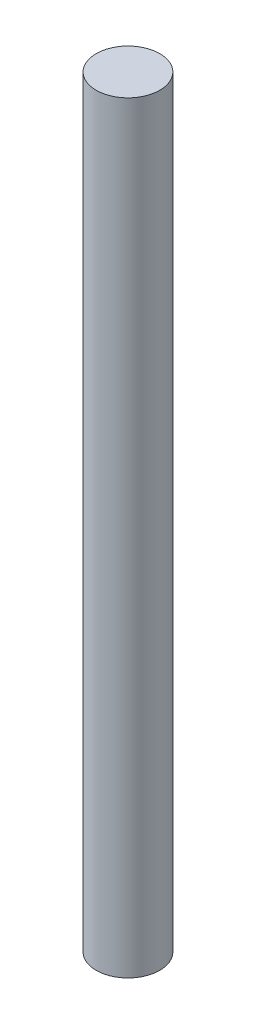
SolidWorks part; units mm, degrees
ref_plane "Front Plane" through (0, 0, 0) normal (0, 0, 1) x (1, 0, 0)
ref_plane "Top Plane" through (0, 0, 0) normal (0, 1, 0) x (1, 0, 0)
ref_plane "Right Plane" through (0, 0, 0) normal (1, 0, 0) x (0, 0, -1)
sketch "Sketch1" plane through (0, 0, 0) normal (0, 1, 0) x (1, 0, 0)
  circle A0 centre (0, 0) radius 9.525
  dimension "D1" = 19.05
extrude "Extrude1" add sketch "Sketch1" along normal blind 228.6
